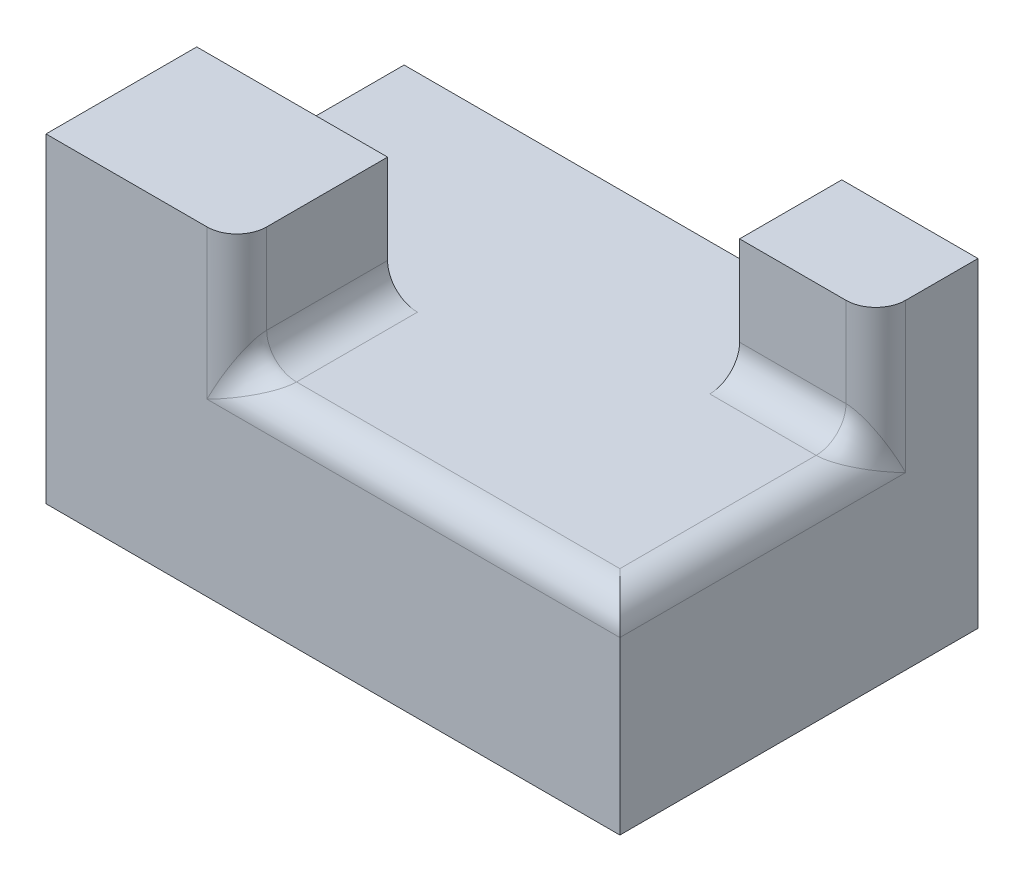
SolidWorks part; units mm, degrees
ref_plane "Front Plane" through (0, 0, 0) normal (0, 0, 1) x (1, 0, 0)
ref_plane "Top Plane" through (0, 0, 0) normal (0, 1, 0) x (1, 0, 0)
ref_plane "Right Plane" through (0, 0, 0) normal (1, 0, 0) x (0, 0, -1)
sketch "Sketch1"
extrude "Extrude1" add sketch "Sketch1" along normal blind 60
sketch "Sketch2"
extrude "Extrude2" add sketch "Sketch2" along normal blind 20
sketch "Sketch3"
extrude "Extrude3" add sketch "Sketch3" along normal blind 20
fillet "Fillet5" radius 5 3 edges
fillet "Fillet8" radius 5 3 edges at (96.149, 33.6618, 36.0601) (84.7369, 33.6618, 17.1202) (96.149, 43.6618, 17.1202)
other "Fillet-Corner6"
other "Fillet-Corner12"
